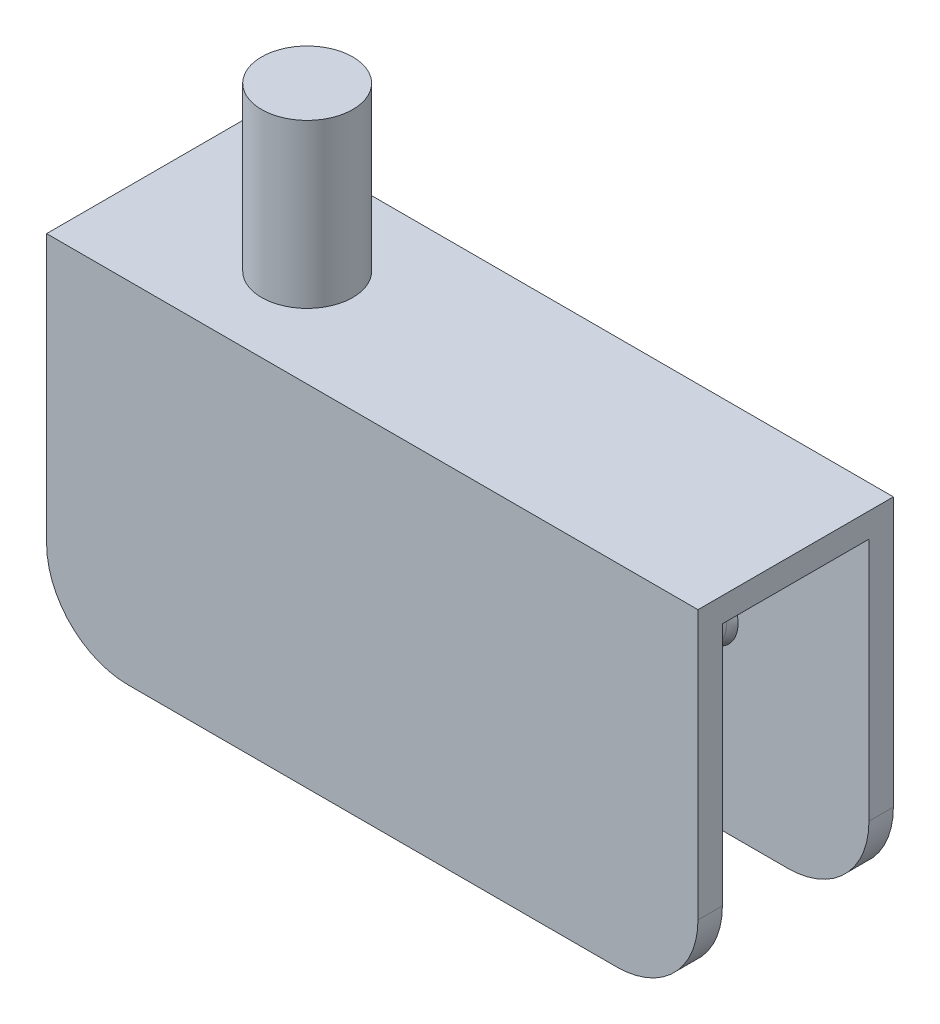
SolidWorks part; units mm, degrees
other "Hinge"
other "<Hinge Screw>-<Fillet4>"
other "<Hinge Screw>-<Fillet4>"
ref_plane "Front Plane" through (0, 0, 0) normal (0, 0, 1) x (1, 0, 0)
ref_plane "Top Plane" through (0, 0, 0) normal (0, 1, 0) x (1, 0, 0)
ref_plane "Right Plane" through (0, 0, 0) normal (1, 0, 0) x (0, 0, -1)
sketch "Sketch1" plane through (0, 0, 0) normal (1, 0, 0) x (0, 0, -1)
  line L1 (0, 0) -> (9, 0)
  line L2 (0, 0) -> (0, 20)
  line L4 (9, 0) -> (9, 20)
extrude "Extrude-Thin1" add sketch "Sketch1" along normal blind 40 thin
fillet "Fillet1" radius 5 4 edges at (0, 20, 0.75) (40, 20, 0.75) (0, 20, -9.75) (40, 20, -9.75)
sketch "Sketch2" plane through (0, -1.5, 0) normal (0, -1, 0) x (1, 0, 0)
  line L0 (0, -4.5) -> (10, -4.5) construction
  line L1 (0, -10.5) -> (0, 1.5) construction
  circle A0 centre (10, -4.5) radius 2.8
extrude "Boss-Extrude1" add sketch "Sketch2" along normal blind 10
sketch "Screw Guide" plane through (0, 0, -10.5) normal (0, 0, -1) x (-1, 0, 0)
  line L0 (0, -1.5) -> (0, 8.5) construction
  line L1 (0, 15) -> (0, -1.5) construction
  line L2 (0, 8.5) -> (-10, 8.5) construction
  line L3 (-10, 8.5) -> (-30, 8.5) construction
sketch "Screw Placement" plane through (0, 0, -10.5) normal (0, 0, -1) x (-1, 0, 0)
  circle A0 centre (-30, 8.5) radius 3.5
  circle A1 centre (-10, 8.5) radius 3.5
sketch "Sketch1-Hinge Screw" plane through (28.4535, -5.4897, -20.2512) normal (0, 1, 0) x (1, 0, 0)
  circle A0 centre (0, 0) radius 3.5
sketch "Sketch2-Hinge Screw" plane through (28.4535, -6.9897, -20.2512) normal (0, -1, 0) x (1, 0, 0)
  circle A2 centre (0, 0) radius 1.7124
sketch "Sketch3-Hinge Screw" plane through (28.4535, -6.69, -20.2512) normal (0, -1, 0) x (-1, 0, 0)
  circle A0 centre (0, 0) radius 2
sketch "Sketch5-Hinge Screw" plane through (28.4535, -5.4897, -20.2512) normal (0, 0, 1) x (1, 0, 0)
  line L6 (2.0696, -1.2003) -> (1.0229, -0.5959)
  line L7 (1.0229, -0.5959) -> (1.0229, -1.8046)
  line L8 (1.0229, -1.8046) -> (2.0696, -1.2003)
  circle A0 centre (1.3718, -1.2003) radius 0.3489 construction
sketch "Sketch6-Hinge Screw" plane through (28.4535, -11.4897, -20.2512) normal (0, -1, 0) x (-1, 0, 0)
  circle A2 centre (0, 0) radius 2
sketch "Sketch8-Hinge Screw" plane through (28.453, -5.4897, -20.2513) normal (-0.9511, -0.0001, -0.309) x (-0.309, 0, 0.9511)
  line L1 (-1.0227, -5.3965) -> (-1.0227, -6.6051)
  line L3 (-1.0227, -6.6051) -> (-2.0694, -6.0008)
  line L4 (-2.0694, -6.0008) -> (-1.0227, -5.3965)
sketch "Sketch9-Hinge Screw" plane through (28.4529, -5.4897, -20.2495) normal (-0.3087, -0.0002, 0.9512) x (0.9512, -0.0001, 0.3087)
  line L6 (-1.8941, -6.376) -> (-0.8474, -6.9803)
  line L7 (-0.8474, -6.9803) -> (-0.8474, -5.7716)
  line L8 (-0.8474, -5.7716) -> (-1.8941, -6.376)
sketch "Sketch10-Hinge Screw" plane through (28.4535, -5.4897, -20.2512) normal (0, 1, 0) x (1, 0, 0)
  line L0 (0.5, 0.5) -> (2, 0.5)
  line L1 (-0.5, -2) -> (0.5, -2)
  line L2 (-0.5, -2) -> (-0.5, -0.5)
  line L3 (-0.5, 2) -> (0.5, 2)
  line L4 (0.5, -2) -> (0.5, -0.5)
  line L5 (-2, -0.5) -> (-0.5, -0.5)
  line L6 (-2, -0.5) -> (-2, 0.5)
  line L7 (-2, 0.5) -> (-0.5, 0.5)
  line L8 (2, -0.5) -> (2, 0.5)
  line L9 (-0.5, 0.5) -> (-0.5, 2)
  line L10 (0.5, 0.5) -> (0.5, 2)
  line L11 (0.5, -0.5) -> (2, -0.5)
  point P0 (0, 0)
  point P5 (0, 0)
inserted part "Hinge Screw"
sketch "Sketch1-Hinge Screw1" plane through (5.5625, -6.4236, -15.951) normal (0, 1, 0) x (1, 0, 0)
  circle A0 centre (0, 0) radius 3.5
sketch "Sketch2-Hinge Screw1" plane through (5.5625, -7.9236, -15.951) normal (0, -1, 0) x (1, 0, 0)
  circle A2 centre (0, 0) radius 1.7124
sketch "Sketch3-Hinge Screw1" plane through (5.5625, -7.6239, -15.951) normal (0, -1, 0) x (-1, 0, 0)
  circle A0 centre (0, 0) radius 2
sketch "Sketch5-Hinge Screw1" plane through (5.5625, -6.4236, -15.951) normal (0, 0, 1) x (1, 0, 0)
  line L6 (2.0696, -1.2003) -> (1.0229, -0.5959)
  line L7 (1.0229, -0.5959) -> (1.0229, -1.8046)
  line L8 (1.0229, -1.8046) -> (2.0696, -1.2003)
  circle A0 centre (1.3718, -1.2003) radius 0.3489 construction
sketch "Sketch6-Hinge Screw1" plane through (5.5625, -12.4236, -15.951) normal (0, -1, 0) x (-1, 0, 0)
  circle A2 centre (0, 0) radius 2
sketch "Sketch8-Hinge Screw1" plane through (5.5621, -6.4236, -15.9512) normal (-0.9511, -0.0001, -0.309) x (-0.309, 0, 0.9511)
  line L1 (-1.0227, -5.3965) -> (-1.0227, -6.6051)
  line L3 (-1.0227, -6.6051) -> (-2.0694, -6.0008)
  line L4 (-2.0694, -6.0008) -> (-1.0227, -5.3965)
sketch "Sketch9-Hinge Screw1" plane through (5.562, -6.4236, -15.9494) normal (-0.3087, -0.0002, 0.9512) x (0.9512, -0.0001, 0.3087)
  line L6 (-1.8941, -6.376) -> (-0.8474, -6.9803)
  line L7 (-0.8474, -6.9803) -> (-0.8474, -5.7716)
  line L8 (-0.8474, -5.7716) -> (-1.8941, -6.376)
sketch "Sketch10-Hinge Screw1" plane through (5.5625, -6.4236, -15.951) normal (0, 1, 0) x (1, 0, 0)
  line L0 (0.5, 0.5) -> (2, 0.5)
  line L1 (-0.5, -2) -> (0.5, -2)
  line L2 (-0.5, -2) -> (-0.5, -0.5)
  line L3 (-0.5, 2) -> (0.5, 2)
  line L4 (0.5, -2) -> (0.5, -0.5)
  line L5 (-2, -0.5) -> (-0.5, -0.5)
  line L6 (-2, -0.5) -> (-2, 0.5)
  line L7 (-2, 0.5) -> (-0.5, 0.5)
  line L8 (2, -0.5) -> (2, 0.5)
  line L9 (-0.5, 0.5) -> (-0.5, 2)
  line L10 (0.5, 0.5) -> (0.5, 2)
  line L11 (0.5, -0.5) -> (2, -0.5)
  point P0 (0, 0)
  point P5 (0, 0)
inserted part "Hinge Screw1"
move or copy body "Body-Move/Copy1" bodies to move or copy 118 placed by mates yes
move or copy body "Body-Move/Copy2" bodies to move or copy 119 placed by mates yes
sketch "Sketch44" plane through (0, 0, -10.5) normal (0, 0, -1) x (-1, 0, 0)
  circle A0 centre (-30, 8.5) radius 3.75
  circle A1 centre (-10, 8.5) radius 3.5
extrude "Cut-Extrude5" cut sketch "Sketch44" against normal blind 1.5 draft 50
mirror "Mirror2" about plane through (0, 0, 0) normal (-1, 0, 0)
combine bodies "Combine2" operation type subtract main body 127 bodies to subtract 122 121 120
move or copy body "Body-Move/Copy3" bodies to move or copy 128 129 130 copy no rotation origin (-20, 4.25, 0) rotation axis (0, 0, 1) rotation angle 180
